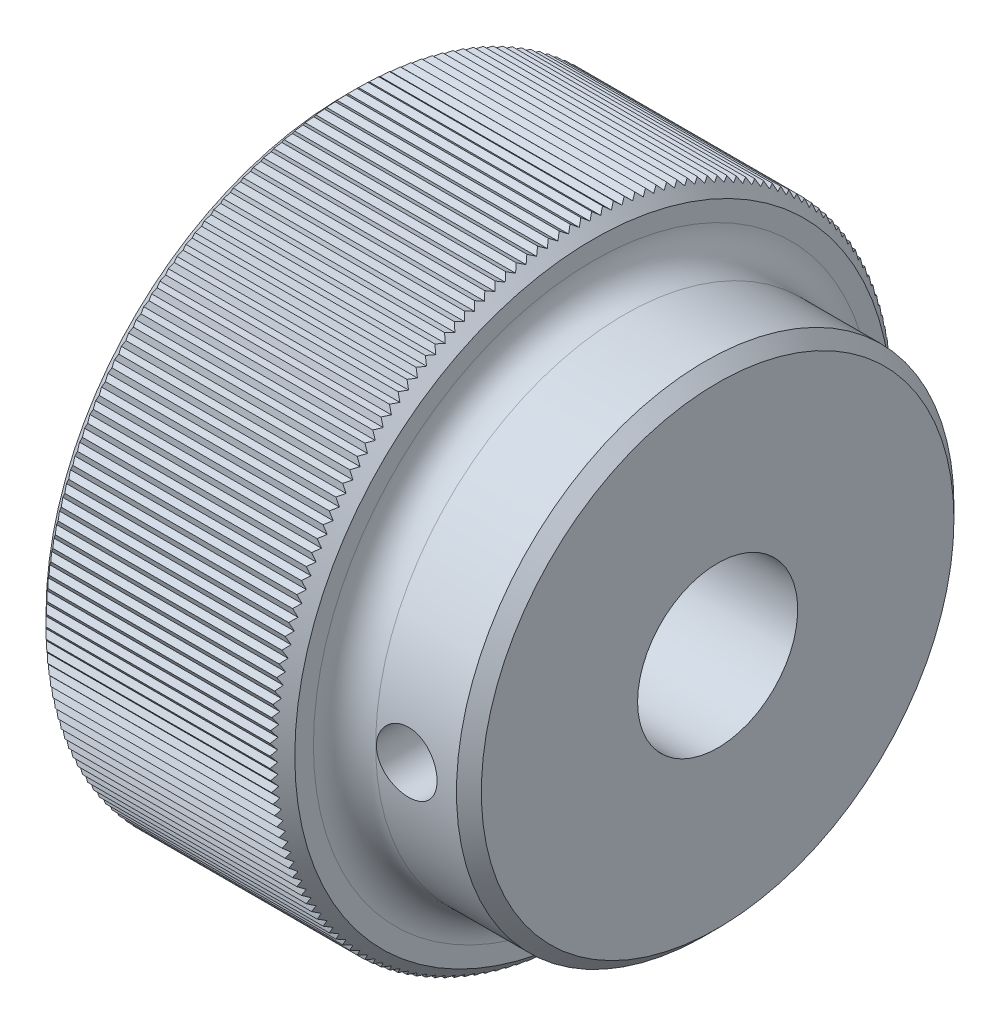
SolidWorks part; units mm, degrees
ref_plane "Front Plane" through (0, 0, 0) normal (0, 0, 1) x (1, 0, 0)
ref_plane "Top Plane" through (0, 0, 0) normal (0, 1, 0) x (1, 0, 0)
ref_plane "Right Plane" through (0, 0, 0) normal (1, 0, 0) x (0, 0, -1)
sketch "Sketch1" plane through (0, 0, 0) normal (1, 0, 0) x (0, 0, -1)
  circle A0 centre (0, 0) radius 20
  dimension "D1" = 40
extrude "Extrude1" add sketch "Sketch1" against normal blind 16
chamfer "Chamfer1" distance 0.8 angle 45 2 edges at (-16, 0, -20) (0, 0, -20)
sketch "Sketch2" plane through (0, 0, 0) normal (1, 0, 0) x (0, 0, -1)
  line L0 (0, 0) -> (0, 50000) construction
  line L1 (0, 0) -> (-872.6203, 49992.3848) construction
  line L2 (0, 20) -> (-0.3447, 19.75)
  line L3 (-0.698, 19.9878) -> (-0.3447, 19.75)
  circle A0 centre (0, 0) radius 20 construction
  arc A1 (-0.698, 19.9878) -> (0, 20) centre (-0.3577, 20.4933) cw
  dimension "D1" = 1
  dimension "D2" = 0.25
extrude "Extrude2" cut sketch "Sketch2" against normal through all
pattern_circular "CirPattern1" count 180 over 360 about axis through (0, 0, 0) along (1, 0, 0) of "Extrude2"
sketch "Sketch3" plane through (0, 0, 0) normal (1, 0, 0) x (0, 0, -1)
  circle A0 centre (0, 0) radius 16
  dimension "D1" = 32
extrude "Extrude3" add sketch "Sketch3" along normal blind 8
fillet "Fillet1" radius 2 1 edges at (0, 0, -16)
sketch "Sketch4" plane through (-16, 0, 0) normal (-1, 0, 0) x (0, 0, 1)
  circle A0 centre (0, 0) radius 5.15
  dimension "D1" = 10.3
extrude "Extrude4" cut sketch "Sketch4" against normal through all
sketch "Sketch5" plane through (-16, 0, 0) normal (-1, 0, 0) x (0, 0, 1)
  circle A0 centre (0, 0) radius 17
  dimension "D1" = 34
extrude "Extrude5" cut sketch "Sketch5" against normal blind 10
chamfer "Chamfer2" distance 0.8 angle 45 3 edges at (-16, 0, 17) (8, 0, -16) (-6, 0, 5.15)
sketch "Sketch6" plane through (0, 0, 0) normal (0, 0, 1) x (1, 0, 0)
  line L0 (8, -15.2) -> (8, 15.2) construction
  circle A0 centre (4, 0) radius 1.95
  dimension "D1" = 3.9
  dimension "D2" = 4
extrude "Extrude6" cut sketch "Sketch6" along normal through all
